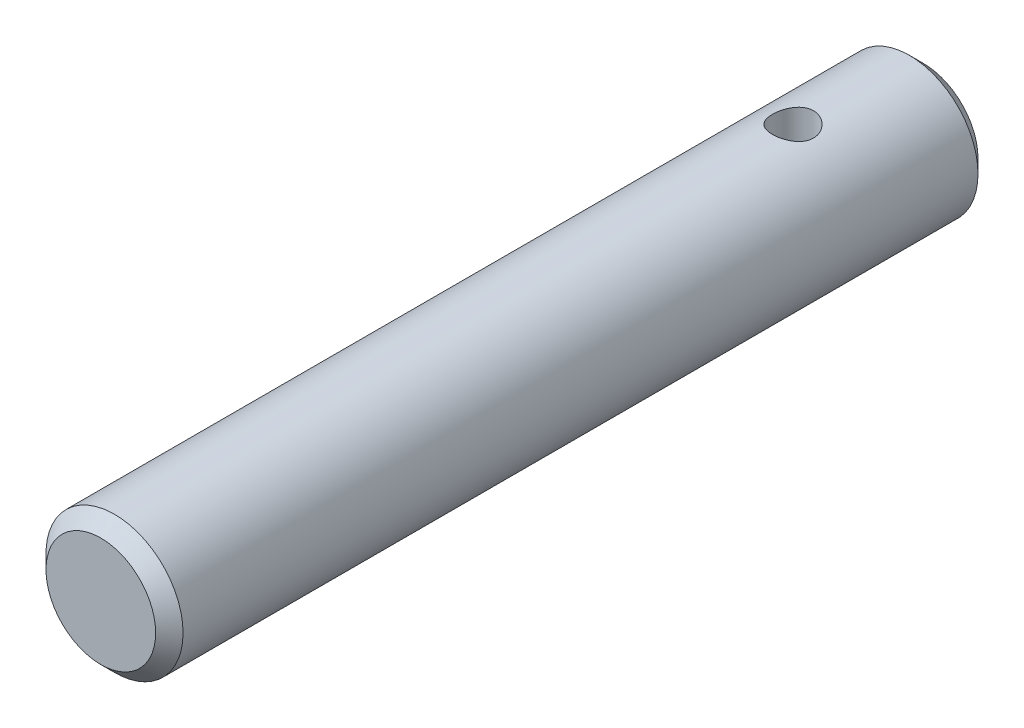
SolidWorks part; units mm, degrees
ref_plane "Face" through (0, 0, 0) normal (0, 0, 1) x (1, 0, 0)
ref_plane "Dessus" through (0, 0, 0) normal (0, 1, 0) x (1, 0, 0)
ref_plane "Droite" through (0, 0, 0) normal (1, 0, 0) x (0, 0, -1)
sketch "Esquisse1" plane through (0, 0, 0) normal (0, 0, 1) x (1, 0, 0)
  circle A0 centre (0, 0) radius 10
  dimension "D1" = 20
extrude "Extrusion1" add sketch "Esquisse1" along normal blind 120
chamfer "Chanfrein1" distance 2 angle 45 2 edges at (10, 0, 0) (10, 0, 120)
sketch "Esquisse2" plane through (0, 0, 0) normal (0, 1, 0) x (1, 0, 0)
  line L0 (0, -118) -> (0, -2) construction
  line L3 (8, 0) -> (-8, 0) construction
  circle A0 centre (0, -19) radius 3
  dimension "D1" = 6
  dimension "D3" = 19
extrude "Enlèv. mat.-Extru.1" cut sketch "Esquisse2" against normal through all and the other way through all
